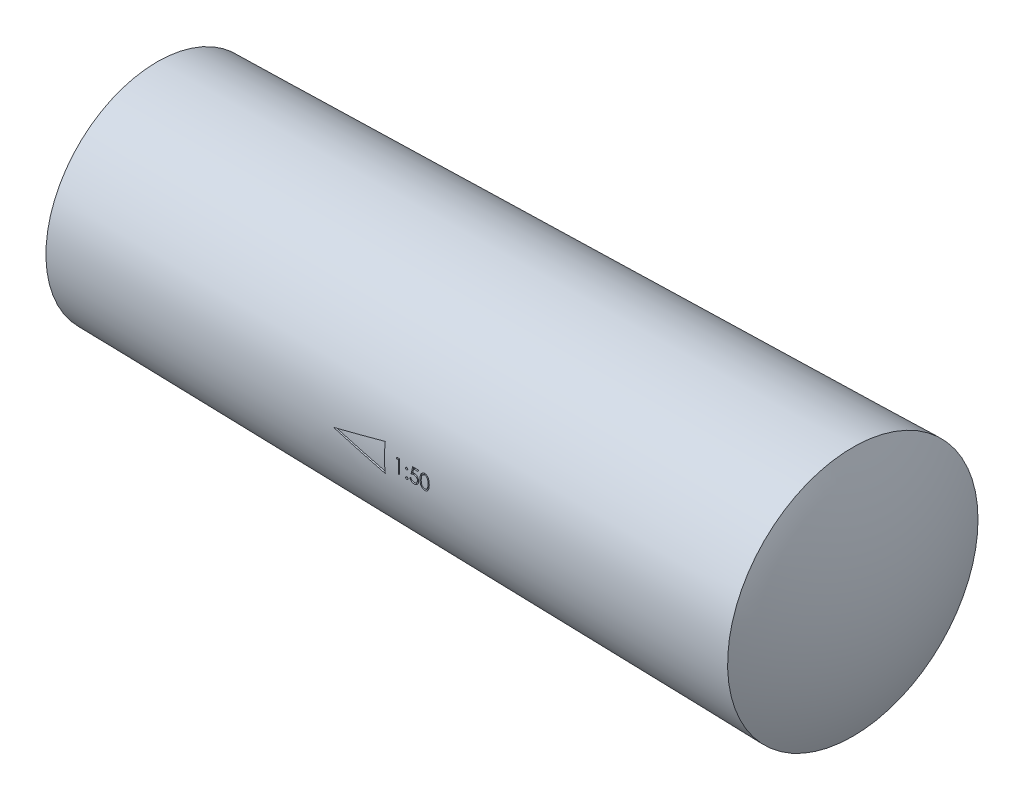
SolidWorks part; units mm, degrees
ref_plane "Front Plane" through (0, 0, 0) normal (0, 0, 1) x (1, 0, 0)
ref_plane "Top Plane" through (0, 0, 0) normal (0, 1, 0) x (1, 0, 0)
ref_plane "Right Plane" through (0, 0, 0) normal (1, 0, 0) x (0, 0, -1)
sketch "Sketch1" plane through (0, 0, 0) normal (1, 0, 0) x (0, 0, -1)
  circle A0 centre (0, 0) radius 8
  dimension "D1" = 16
extrude "Extrude1" add sketch "Sketch1" along normal mid plane 50
draft "Draft1" type of draft neutral plane draft angle 1.146 faces to draft 1 parameters "D1"=1.146
sketch "Sketch2" plane through (0, 0, 0) normal (0, 0, 1) x (1, 0, 0)
  line L0 (-25, 0) -> (-25, 8)
  line L1 (-25, 8) -> (-25, -8) construction
  line L2 (-25, 0) -> (-27, 0)
  line L3 (-27, 0) -> (-27, -8.5) construction
  line L4 (25, 0) -> (25, 9)
  line L5 (25, -9) -> (25, 9) construction
  line L6 (25, 0) -> (27, 0)
  line L7 (27, 0) -> (27, -8.5) construction
  line L8 (-25, -8) -> (25, -9) construction
  arc A0 (-27, 0) -> (-25, 8) centre (-10, 0) cw
  arc A1 (27, 0) -> (25, 9) centre (5.7499, 0) ccw
  point P14 (0, -8.5)
revolve "Revolve1" add sketch "Sketch2" angle 360 about L2
sketch "Sketch5" plane through (0, 0, 0) normal (0, 0, 1) x (1, 0, 0)
  line L0 (0, 8.5) -> (0, -8.5) construction
  line L1 (25, 9) -> (-25, 8) construction
  line L2 (-25, -8) -> (25, -9) construction
ref_plane "Plane2" through (0, 0, 0) normal (-0.02, 0, 0.9998) x (0.9998, 0, 0.02)
sketch "Sketch6" plane through (0, 0, 0) normal (-0.02, 0, 0.9998) x (0.9998, 0, 0.02)
  line L0 (0, 0) -> (0, 1)
  line L1 (0, 8.5) -> (0, -8.5) construction
  line L2 (0, 1) -> (-3.7321, 0)
  line L3 (-3.7321, 0) -> (0, -1)
  line L4 (0, -1) -> (0, 0)
  line L5 (0, -0.5) -> (4, -0.5) construction
  text T0 "1:50" font "Century Gothic" height 1
  dimension "D1" = 2
  dimension "D2" = 30
  dimension "D3" = 4
wrap "Wrap2" sketch "Sketch6" wrap type deboss source sketch "Sketch6" thickness 0.1 parameters "D1"=0.1
equation "\"D2@Sketch2\" = \"D1@Sketch2\""
